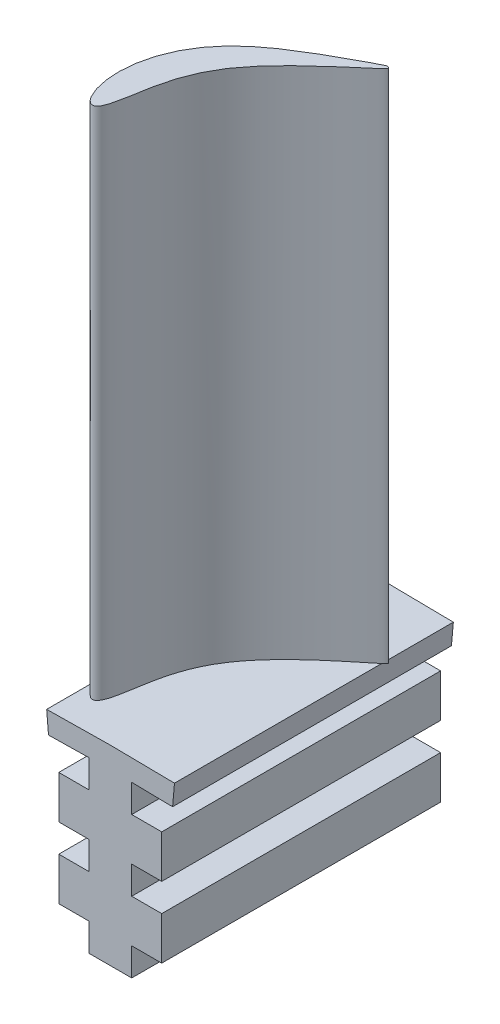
SolidWorks part; units mm, degrees
ref_plane "Front Plane" through (0, 0, 0) normal (0, 0, 1) x (1, 0, 0)
ref_plane "Top Plane" through (0, 0, 0) normal (0, 1, 0) x (1, 0, 0)
ref_plane "Right Plane" through (0, 0, 0) normal (1, 0, 0) x (0, 0, -1)
sketch "Sketch1" plane through (0, 0, 0) normal (0, 0, 1) x (1, 0, 0)
  line L0 (0, 555.125) -> (0, 848.8318) construction
  line L1 (-14.3887, 554.9385) -> (-14.8247, 559.922)
  line L2 (14.5315, 554.9348) -> (14.9675, 559.9182)
  line L3 (0, 555.125) -> (0, 621.4391) construction
  line L4 (5, 555.1025) -> (5, 548.6025)
  line L5 (5, 548.6025) -> (12, 548.6025)
  line L6 (12, 548.6025) -> (12, 538.6025)
  line L7 (12, 538.6025) -> (5, 538.6025)
  line L8 (5, 538.6025) -> (5, 532.1025)
  line L9 (5, 532.1025) -> (12, 532.1025)
  line L10 (12, 532.1025) -> (12, 522.1025)
  line L11 (12, 522.1025) -> (5, 522.1025)
  line L12 (5, 522.1025) -> (5, 515.6025)
  line L13 (5, 515.6025) -> (-5, 515.6025)
  line L14 (-5, 522.1025) -> (-5, 515.6025)
  line L15 (-12, 522.1025) -> (-5, 522.1025)
  line L16 (-12, 532.1025) -> (-12, 522.1025)
  line L17 (-5, 532.1025) -> (-12, 532.1025)
  line L18 (-5, 538.6025) -> (-5, 532.1025)
  line L19 (-12, 538.6025) -> (-5, 538.6025)
  line L20 (-12, 548.6025) -> (-12, 538.6025)
  line L21 (-5, 548.6025) -> (-12, 548.6025)
  line L22 (-5, 555.1025) -> (-5, 548.6025)
  arc A0 (14.5315, 554.9348) -> (5, 555.1025) centre (0, 0) ccw
  arc A1 (14.9675, 559.9182) -> (-14.8247, 559.922) centre (0, 0) ccw
  arc A2 (-5, 555.1025) -> (-14.3887, 554.9385) centre (0, 0) ccw
  point P21 (0, 515.6025)
  dimension "D1" = 1110.25
  dimension "D2" = 5
  dimension "D3" = 5
  dimension "D4" = 6.5
  dimension "D5" = 10
  dimension "D6" = 6.5
  dimension "D7" = 10
  dimension "D8" = 6.5
  dimension "D9" = 12
  dimension "D10" = 12
  dimension "D11" = 7
  dimension "D12" = 7
extrude "Boss-Extrude1" add sketch "Sketch1" along normal blind 65 contours L1 A1 L2 A0 L4 L5 L6 L7 L8 L9 L10 L11 L12 L13 L14 L15 L16 L17 L18 L19 L20 L21 L22 A2
ref_plane "Plane1" through (0, 800, 0) normal (0, 1, 0) x (1, 0, 0)
sketch "Sketch2" plane through (0, 800, 0) normal (0, 1, 0) x (1, 0, 0)
  line L0 (-37.8596, 34.047) -> (190.4937, 22.0795) construction
  line L1 (15.6172, -15.7517) -> (15.5218, -15.6405) construction
  line L2 (15.0466, -15.5097) -> (13.5642, -16.1027) construction
  line L3 (13.5642, -16.1027) -> (12.7489, -16.6956) construction
  line L4 (12.7489, -16.6956) -> (11.1924, -17.511) construction
  line L5 (11.1924, -17.511) -> (9.9323, -18.2522) construction
  line L6 (9.9323, -18.2522) -> (9.1911, -18.5487) construction
  line L7 (9.1911, -18.5487) -> (4.0768, -21.217) construction
  line L8 (4.0768, -21.217) -> (1.4084, -22.6994) construction
  line L9 (1.4084, -22.6994) -> (-0.2963, -23.8112) construction
  line L10 (-0.2963, -23.8112) -> (-3.3353, -25.7384) construction
  line L11 (-3.3353, -25.7384) -> (-5.9295, -27.369) construction
  line L12 (-5.9295, -27.369) -> (-8.079, -29.222) construction
  line L13 (-8.079, -29.222) -> (-10.3767, -30.6303) construction
  line L14 (-10.3767, -30.6303) -> (-12.6745, -32.5) construction
  line L15 (-12.6745, -32.5) -> (-15.9358, -36.9306) construction
  line L16 (-15.9358, -36.9306) -> (-17.1958, -40.4142) construction
  line L17 (-17.1958, -40.4142) -> (-17.7888, -44.8615) construction
  line L18 (-17.7888, -44.8615) -> (-17.1958, -49.5311) construction
  line L19 (-17.1958, -49.5311) -> (-16.8425, -51.4481) construction
  line L20 (15.5218, -15.6405) -> (15.4349, -15.5981) construction
  line L21 (-16.8425, -51.4481) -> (-16.06, -54.3226) construction
  line L22 (-16.06, -54.3226) -> (-15.3538, -56.8981) construction
  line L23 (-15.3538, -56.8981) -> (-13.8999, -59.0582) construction
  line L24 (-13.8999, -59.0582) -> (-12.6952, -61.0106) construction
  line L25 (-12.6952, -61.0106) -> (-10.9505, -62.2568) construction
  line L26 (-10.9505, -62.2568) -> (-9.6627, -62.506) construction
  line L27 (-9.6627, -62.506) -> (-8.915, -61.7998) construction
  line L28 (-8.915, -61.7998) -> (-8.5411, -58.9335) construction
  line L29 (-8.5411, -58.9335) -> (-8.5411, -57.2304) construction
  line L30 (-8.5411, -57.2304) -> (-8.9981, -54.281) construction
  line L31 (-8.9981, -54.281) -> (-9.3304, -51.5809) construction
  line L32 (-9.3304, -51.5809) -> (-9.3304, -49.3377) construction
  line L33 (-9.3304, -49.3377) -> (-9.0812, -47.3853) construction
  line L34 (-9.0812, -47.3853) -> (-8.5411, -44.8514) construction
  line L35 (-8.5411, -44.8514) -> (-7.8765, -42.5666) construction
  line L36 (-7.8765, -42.5666) -> (-6.8795, -39.8665) construction
  line L37 (-6.8795, -39.8665) -> (-6.0487, -38.2464) construction
  line L38 (-6.0487, -38.2464) -> (-5.0933, -36.5848) construction
  line L39 (-5.0933, -36.5848) -> (-4.0963, -34.8817) construction
  line L40 (-4.0963, -34.8817) -> (-3.3901, -34.0924) construction
  line L41 (-3.3901, -34.0924) -> (-1.9362, -32.5) construction
  line L42 (-1.9362, -32.5) -> (-0.9808, -30.8938) construction
  line L43 (-0.9808, -30.8938) -> (1.8619, -28.0685) construction
  line L44 (1.8619, -28.0685) -> (3.8718, -26.3312) construction
  line L45 (3.8718, -26.3312) -> (5.2004, -24.73) construction
  line L46 (5.2004, -24.73) -> (6.9718, -23.2311) construction
  line L47 (6.9718, -23.2311) -> (10.3851, -20.8007) construction
  line L48 (10.3851, -20.8007) -> (12.4173, -18.7685) construction
  line L49 (12.4173, -18.7685) -> (14.0991, -17.7874) construction
  line L50 (14.0991, -17.7874) -> (14.94, -16.7363) construction
  line L51 (14.94, -16.7363) -> (15.7109, -16.1056) construction
  line L52 (15.7109, -16.1056) -> (15.7109, -15.9232) construction
  line L53 (15.7109, -15.9232) -> (15.7255, -15.8781) construction
  line L54 (15.7255, -15.8781) -> (15.6172, -15.7517) construction
  line L55 (15.4349, -15.5981) -> (15.3775, -15.5971) construction
  line L56 (15.3775, -15.5971) -> (15.2582, -15.5971) construction
  line L57 (15.2582, -15.5971) -> (15.0466, -15.5097) construction
  spline_without_curve S0
  spline_without_curve S1
extrude "Boss-Extrude2" add sketch "Sketch2" against normal up to surface (240.0995 mm away) contours S0 S1
sketch "Sketch4" plane through (0, 800, 0) normal (0, 1, 0) x (1, 0, 0)
  line L0 (-15.3915, 1.1731) -> (-15.9511, -65.7067)
  line L1 (-15.3915, 1.1731) -> (16.3526, 0.9074)
  line L2 (-15.9511, -65.7067) -> (15.7929, -65.9723)
  line L3 (16.3526, 0.9074) -> (15.7929, -65.9723)
extrude "Cut-Extrude1" cut sketch "Sketch4" against normal blind 120 contours L0 L2 L3 L1
